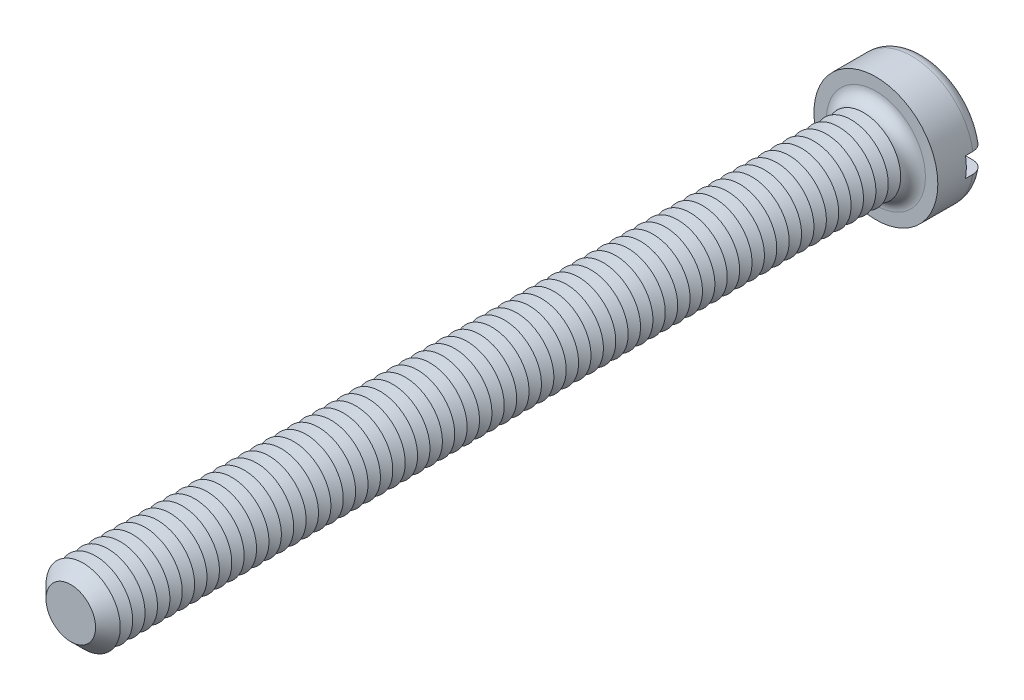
SolidWorks part; units mm, degrees
ref_plane "Front Plane" through (0, 0, 0) normal (0, 0, 1) x (1, 0, 0)
ref_plane "Top Plane" through (0, 0, 0) normal (0, 1, 0) x (1, 0, 0)
ref_plane "Right Plane" through (0, 0, 0) normal (1, 0, 0) x (0, 0, -1)
sketch "Sketch3" plane through (0, 0, 0) normal (0, 0, 1) x (1, 0, 0)
  circle A0 centre (0, 0) radius 5
  dimension "D1" = 10
extrude "Boss-Extrude2" add sketch "Sketch3" against normal blind 3.9
sketch "Sketch4" plane through (0, 0, 0) normal (0, 0, 1) x (1, 0, 0)
  circle A0 centre (0, 0) radius 3
  dimension "D1" = 6
extrude "Boss-Extrude3" add sketch "Sketch4" along normal blind 65
fillet "Fillet1" radius 1 2 edges at (5, 0, -3.9) (3, 0, 0)
chamfer "Chamfer1" distance 1 angle 45 1 edges at (3, 0, 65)
sketch "Sketch5" plane through (0, 0, 0) normal (1, 0, 0) x (0, 0, -1)
  line L0 (1.6944, 0) -> (-7.6738, 0) construction
sketch "Sketch6" plane through (0, 0, 0) normal (1, 0, 0) x (0, 0, -1)
  line L0 (-1, 3) -> (-1.5, 2.134)
  line L1 (-1.5, 2.134) -> (-2, 3)
  line L2 (-1, 3) -> (-64, 3) construction
  line L3 (-2, 3) -> (-1, 3)
  dimension "D1" = 1
revolve "Cut-Revolve1" cut sketch "Sketch6" angle 360 about L0
pattern_linear "LPattern1" count 63 spacing 1 along (0, 0, 1) of "Cut-Revolve1"
sketch "Sketch8" plane through (0, 0, -3.9) normal (0, 0, -1) x (-1, 0, 0)
  line L1 (5, -0.8) -> (-5, -0.8)
  line L2 (5, -0.8) -> (5, 0.8)
  line L3 (5, 0.8) -> (-5, 0.8)
  line L4 (-5, -0.8) -> (-5, 0.8)
  line L5 (5, -0.8) -> (-5, 0.8) construction
  line L6 (5, 0.8) -> (-5, -0.8) construction
  point P0 (0, 0)
  dimension "D1" = 10
  dimension "D2" = 1.6
extrude "Cut-Extrude1" cut sketch "Sketch8" against normal blind 1.6
